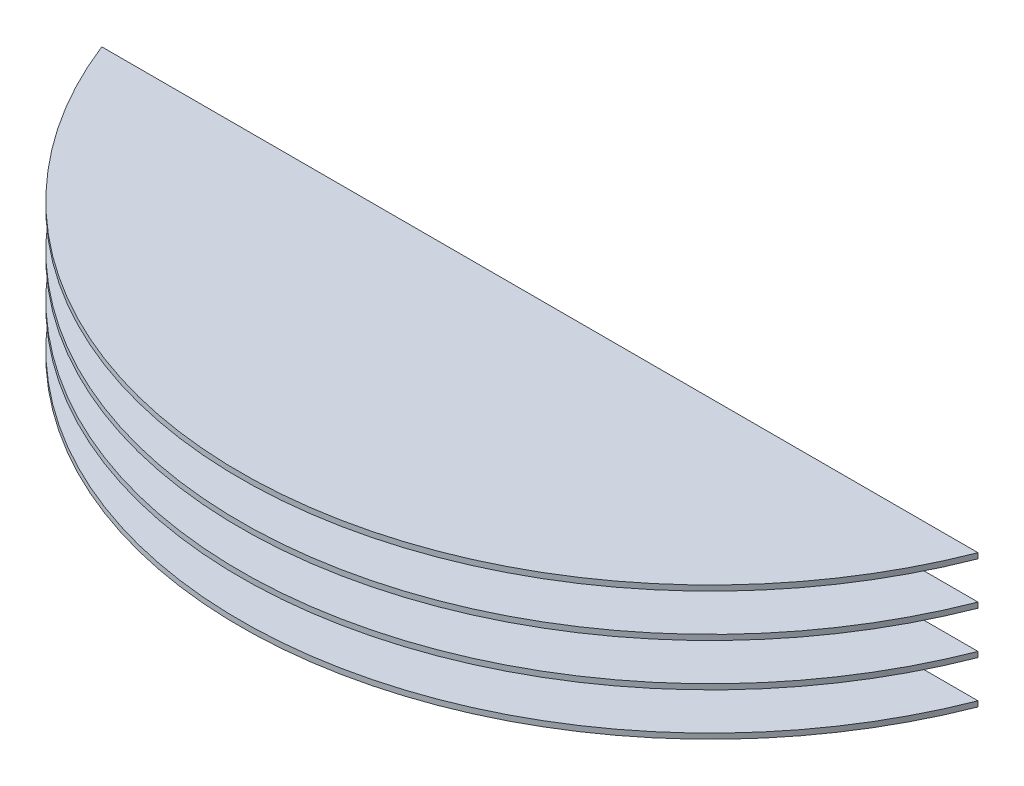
SolidWorks part; units mm, degrees
ref_plane "Front Plane" through (0, 0, 0) normal (0, 0, 1) x (1, 0, 0)
ref_plane "Top Plane" through (0, 0, 0) normal (0, 1, 0) x (1, 0, 0)
ref_plane "Right Plane" through (0, 0, 0) normal (1, 0, 0) x (0, 0, -1)
sketch "Sketch1" plane through (0, 0, 0) normal (0, 0, 1) x (1, 0, 0)
  line L0 (0, -0.8024) -> (0, 83.3566) construction
  line L1 (-12.7, -12.7) -> (-127, -12.7) construction
  line L2 (-38.1, -9.525) -> (-38.1, -7.9375)
  line L3 (-38.1, 4.7625) -> (-139.7, 4.7625)
  line L4 (0, -0.8024) -> (-12.7, -12.7) construction
  line L5 (-139.7, -9.525) -> (-139.7, -7.9375)
  line L6 (-38.1, -9.525) -> (-139.7, -9.525)
  line L7 (-38.1, -7.9375) -> (-139.7, -7.9375)
  line L8 (-38.1, 3.175) -> (-139.7, 3.175)
  line L9 (-38.1, 3.175) -> (-38.1, 4.7625)
  line L10 (-139.7, 3.175) -> (-139.7, 4.7625)
  line L11 (-38.1, 17.4625) -> (-139.7, 17.4625)
  line L12 (-38.1, 15.875) -> (-139.7, 15.875)
  line L13 (-38.1, 15.875) -> (-38.1, 17.4625)
  line L14 (-139.7, 15.875) -> (-139.7, 17.4625)
  line L15 (-38.1, 30.1625) -> (-139.7, 30.1625)
  line L16 (-38.1, 28.575) -> (-139.7, 28.575)
  line L17 (-38.1, 28.575) -> (-38.1, 30.1625)
  line L18 (-139.7, 28.575) -> (-139.7, 30.1625)
  dimension "D1" = 4
  dimension "D3" = 76.2
  dimension "D4" = 279.4
  dimension "D5" = 12.7
  dimension "D6" = 1.5875
  dimension "D7" = 3.175
revolve "Revolve1" add sketch "Sketch1" angle 180 about L0
sketch "Sketch2" plane through (0, 30.1625, 0) normal (0, 1, 0) x (1, 0, 0)
  line L0 (0, -50.8) -> (-185.6231, -50.8)
  line L1 (-185.6231, -50.8) -> (-185.6231, 0)
  line L2 (-185.6231, 0) -> (0, 0)
  line L3 (0, 0) -> (0, -50.8) construction
  line L4 (0, -50.8) -> (142.8986, -50.8)
  line L5 (142.8986, -50.8) -> (142.8986, 0)
  line L6 (142.8986, 0) -> (0, 0)
  dimension "D1" = 50.8
extrude "Cut-Extrude1" cut sketch "Sketch2" against normal through all
